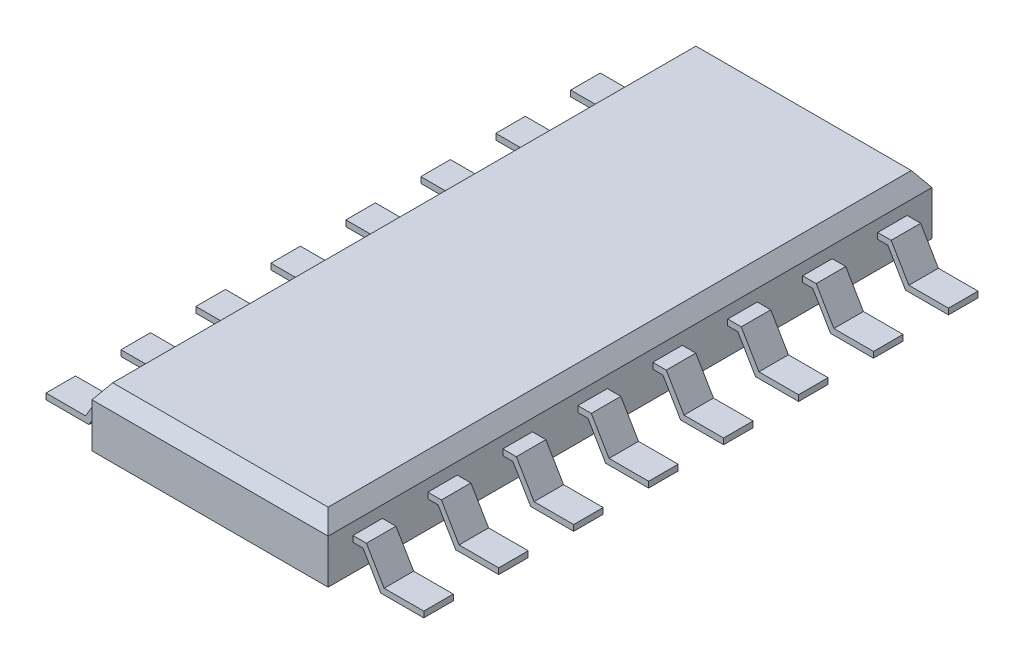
SolidWorks part; units mm, degrees
ref_plane "Front Plane" through (0, 0, 0) normal (0, 0, 1) x (1, 0, 0)
ref_plane "Top Plane" through (0, 0, 0) normal (0, 1, 0) x (1, 0, 0)
ref_plane "Right Plane" through (0, 0, 0) normal (1, 0, 0) x (0, 0, -1)
sketch "Sketch1" plane through (0, 0, 0) normal (0, 1, 0) x (1, 0, 0)
  line L0 (0, 6.8835) -> (0, -6.8835) construction
  line L1 (-5.5575, 0) -> (5.5575, 0) construction
  line L3 (-2, 5.75) -> (2, 5.75)
  line L4 (-2, 5.75) -> (-2, -5.75)
  line L5 (-2, -5.75) -> (2, -5.75)
  line L6 (2, 5.75) -> (2, -5.75)
  dimension "D1" = 4
  dimension "D2" = 11.5
extrude "Extrude1" add sketch "Sketch1" along normal mid plane 1
chamfer "Chamfer1" distance 0.25 angle 35 4 edges at (0, 0.5, -5.75) (2, 0.5, 0) (0, 0.5, 5.75) (-2, 0.5, 0)
sketch "Sketch4" plane through (0, 0, 0) normal (0, 0, 1) x (1, 0, 0)
  line L0 (0, 1.2724) -> (0, -0.9364) construction
  line L1 (-2, 1.8525) -> (-2, -1.3157) construction
  line L2 (-2, 0.25) -> (-2, -0.5) construction
  line L3 (0, 0) -> (-6.2695, 0) construction
  line L4 (-3.2, 1.2724) -> (-3.2, -1.1019) construction
  line L5 (-2, 0) -> (-2.2, 0)
  line L6 (-2.2, 0) -> (-2.5, -0.51)
  line L7 (-2.5, -0.51) -> (-3.2, -0.51)
  line L9 (-2, -0.5) -> (2, -0.5) construction
  point P19 (-2.2, 0)
  point P22 (-2.5, -0.51)
  dimension "D1" = 1.2
  dimension "D2" = 0.01
  dimension "D3" = 0.7
  dimension "D4" = 0.2
extrude "Extrude-Thin1" add sketch "Sketch4" along normal mid plane 0.5 thin
pattern_linear "LPattern1" count 5 spacing 1.27 along (0, 0, -1) count 4 spacing 1.27 along (0, 0, 1) of "Extrude-Thin1"
mirror "Mirror1" about plane through (0, 0, 0) normal (1, 0, 0) of "LPattern1", "Extrude-Thin1"
other "Move Face1" parameters "D1"=1.27
